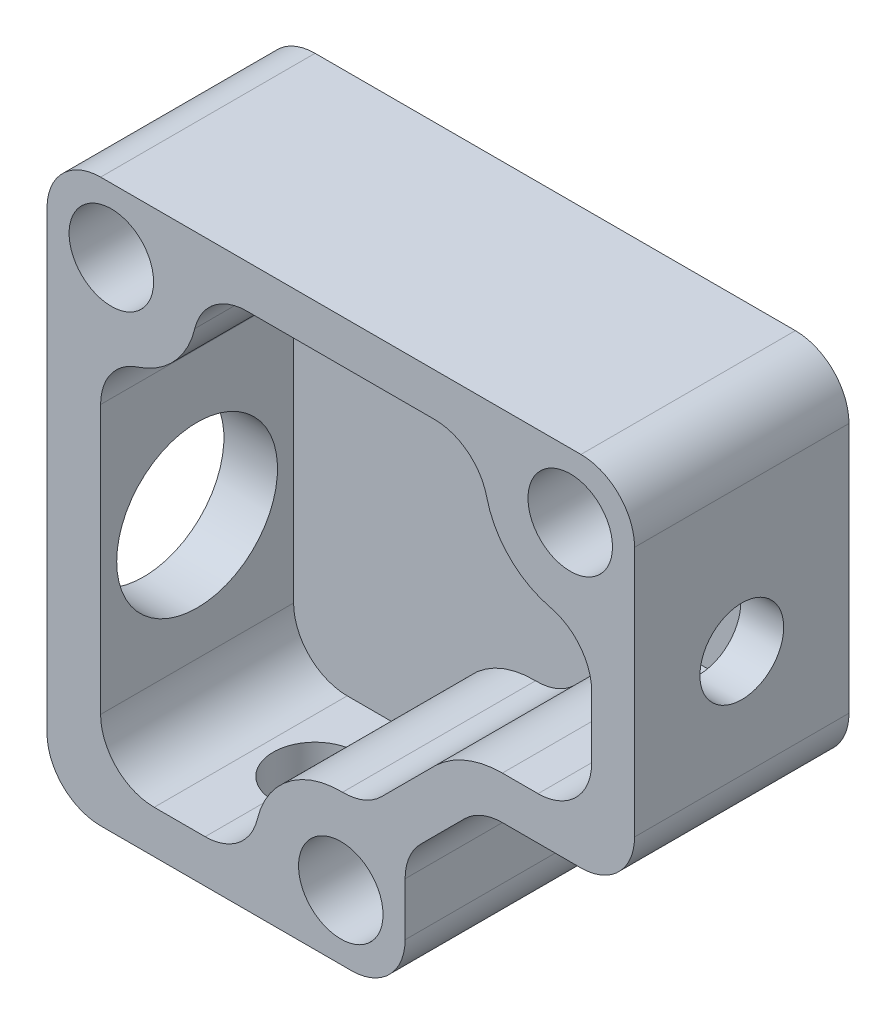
SolidWorks part; units mm, degrees
ref_plane "Front Plane" through (0, 0, 0) normal (0, 0, 1) x (1, 0, 0)
ref_plane "Top Plane" through (0, 0, 0) normal (0, 1, 0) x (1, 0, 0)
ref_plane "Right Plane" through (0, 0, 0) normal (1, 0, 0) x (0, 0, -1)
sketch "Sketch1" plane through (0, 0, 0) normal (0, 0, 1) x (1, 0, 0)
  line L1 (0, 0) -> (69.596, 0)
  line L2 (0, 0) -> (0, 66.548)
  line L3 (0, 66.548) -> (69.596, 66.548)
  line L4 (69.596, 0) -> (69.596, 66.548)
  circle A0 centre (7.62, 58.928) radius 5.0038
  circle A1 centre (61.976, 58.928) radius 5.0038
  circle A2 centre (34.798, 7.62) radius 5.0038
  dimension "D3" = 10.0076
  dimension "D4" = 10.0076
  dimension "D5" = 10.0076
  dimension "D2" = 7.62
  dimension "D6" = 7.62
  dimension "D7" = 54.356
  dimension "D8" = 7.62
  dimension "D9" = 51.308
  dimension "D10" = 61.976
  dimension "D11" = 27.178
  dimension "D12" = 7.62
extrude "Boss-Extrude1" add sketch "Sketch1" along normal blind 25.4
sketch "Sketch4" plane through (0, 0, 25.4) normal (0, 0, 1) x (1, 0, 0)
  line L1 (69.596, 0) -> (42.418, 0)
  line L2 (69.596, 0) -> (69.596, 24.13)
  line L3 (69.596, 24.13) -> (51.308, 24.13)
  line L4 (42.418, 0) -> (42.418, 15.24)
  line L5 (0, 66.548) -> (0, 0) construction
  line L6 (69.596, 66.548) -> (0, 66.548) construction
  line L7 (51.308, 24.13) -> (42.418, 15.24)
  dimension "D1" = 42.418
  dimension "D2" = 42.418
  dimension "D3" = 45
  dimension "D4" = 8.89
extrude "Cut-Extrude1" cut sketch "Sketch4" against normal blind 44.45
fillet "Fillet1" radius 6.35 2 edges at (42.418, 15.24, 12.7) (51.308, 24.13, 12.7)
fillet "Fillet2" radius 6.35 5 edges at (0, 0, 12.7) (42.418, 0, 12.7) (69.596, 24.13, 12.7) (69.596, 66.548, 12.7) (0, 66.548, 12.7)
sketch "Sketch5" plane through (0, 0, 0) normal (0, -1, 0) x (1, 0, 0)
  line L0 (6.35, 25.4) -> (36.068, 25.4) construction
  line L1 (0, 0) -> (0, 25.4) construction
  point P0 (19.05, 12.7)
  dimension "D1" = 12.7
  dimension "D2" = 19.05
hole_wizard "25/64 (0.39063) Diameter Hole1" positions "Sketch6" profile "Sketch7" hole size "25/64" standard "ANSI Inch"
sketch "Sketch6" plane through (0, 0, 0) normal (0, -1, 0) x (-1, 0, 0)
  point P0 (-19.05, -12.7)
sketch "Sketch7" plane through (19.05, 0, 12.7) normal (1, 0, 0) x (0, 0, -1)
  line L0 (0, 0) -> (0, 15.6809)
  line L1 (0, 15.6809) -> (4.961, 12.7)
  line L2 (4.961, 12.7) -> (4.961, 0)
  line L5 (4.961, 0) -> (0, 0)
  line L10 (0, 15.6809) -> (-4.961, 12.7) construction
  line L11 (0, -6.35) -> (0, 107.95) construction
  dimension "Hole Dia." = 9.922
  dimension "Hole Depth" = 12.7
  dimension "Drill Angle" = 118
sketch "Sketch11" plane through (69.596, 0, 0) normal (1, 0, 0) x (0, 0, -1)
  line L1 (-25.4, 30.48) -> (-25.4, 60.198) construction
  line L2 (0, 24.13) -> (-25.4, 24.13) construction
  point P0 (-12.7, 43.18)
  dimension "D1" = 19.05
  dimension "D2" = 12.7
hole_wizard "25/64 (0.39063) Diameter Hole2" positions "Sketch12" profile "Sketch13" hole size "25/64" standard "ANSI Inch"
sketch "Sketch12" plane through (69.596, 0, 0) normal (1, 0, 0) x (0, 0, -1)
  point P0 (-12.7, 43.18)
sketch "Sketch13" plane through (69.596, 43.18, 12.7) normal (0, 1, 0) x (0, 0, -1)
  line L0 (0, 0) -> (0, 28.3809)
  line L1 (0, 28.3809) -> (4.961, 25.4)
  line L2 (4.961, 25.4) -> (4.961, 0)
  line L5 (4.961, 0) -> (0, 0)
  line L10 (0, 28.3809) -> (-4.961, 25.4) construction
  line L11 (0, -6.35) -> (0, 107.95) construction
  dimension "Hole Dia." = 9.922
  dimension "Hole Depth" = 25.4
  dimension "Drill Angle" = 118
sketch "Sketch15" plane through (0, 0, 0) normal (-1, 0, 0) x (0, 0, 1)
  line L0 (25.4, 0) -> (0, 0) construction
  line L1 (0, 60.198) -> (0, 6.35) construction
  point P0 (13.97, 26.162)
  point P1 (21.59, 50.3921)
  dimension "D1" = 25.4
  dimension "D2" = 13.97
  dimension "D3" = 21.59
  dimension "D4" = 26.162
hole_wizard "M6x1.0 Tapped Hole2" positions "Sketch18" profile "Sketch19" tap size "M6x1.0" standard "ANSI Metric"
sketch "Sketch18" plane through (0, 0, 0) normal (-1, 0, 0) x (0, 0, 1)
  point P0 (21.59, 50.3921)
sketch "Sketch19" plane through (0, 50.3921, 21.59) normal (0, 1, 0) x (0, 0, 1)
  line L0 (0, 0) -> (0, 4.0422)
  line L1 (0, 4.0422) -> (2.5, 2.54)
  line L2 (2.5, 2.54) -> (2.5, 0)
  line L5 (2.5, 0) -> (0, 0)
  line L10 (0, 4.0422) -> (-2.5, 2.54) construction
  line L11 (0, -6.35) -> (0, 107.95) construction
  dimension "Tap Drill Dia." = 5
  dimension "Tap Drill Depth" = 2.54
  dimension "Drill Angle" = 118
hole_wizard "3/4 (0.75) Diameter Hole1" positions "Sketch20" profile "Sketch21" hole size "3/4" standard "ANSI Inch"
sketch "Sketch20" plane through (0, 0, 0) normal (-1, 0, 0) x (0, 0, 1)
  point P0 (13.97, 26.162)
sketch "Sketch21" plane through (0, 26.162, 13.97) normal (0, 1, 0) x (0, 0, 1)
  line L0 (0, 0) -> (0, 18.4232)
  line L1 (0, 18.4232) -> (9.525, 12.7)
  line L2 (9.525, 12.7) -> (9.525, 0)
  line L5 (9.525, 0) -> (0, 0)
  line L10 (0, 18.4232) -> (-9.525, 12.7) construction
  line L11 (0, -6.35) -> (0, 107.95) construction
  dimension "Hole Dia." = 19.05
  dimension "Hole Depth" = 12.7
  dimension "Drill Angle" = 118
sketch "Sketch23" plane through (0, 0, 25.4) normal (0, 0, 1) x (1, 0, 0)
  line L0 (23.6844, 61.468) -> (45.9116, 61.468)
  line L1 (64.516, 42.8636) -> (64.516, 35.56)
  line L2 (58.166, 29.21) -> (53.9393, 29.21)
  line L4 (46.0596, 26.0658) -> (37.4276, 17.4338)
  line L5 (63.246, 66.548) -> (6.35, 66.548) construction
  line L6 (69.596, 30.48) -> (69.596, 60.198) construction
  line L7 (63.246, 24.13) -> (53.9383, 24.13) construction
  line L8 (49.4481, 22.2701) -> (44.2779, 17.0999) construction
  line L9 (6.35, 43.219) -> (6.35, 11.43)
  line L10 (12.7, 5.08) -> (18.7336, 5.08)
  line L11 (0, 60.198) -> (0, 6.35) construction
  line L12 (6.35, 0) -> (36.068, 0) construction
  arc A0 (10.7462, 49.2609) -> (17.5058, 56.5834) centre (7.62, 58.928) ccw
  arc A1 (52.0902, 56.5834) -> (59.6314, 49.0422) centre (61.976, 58.928) ccw
  arc A2 (37.4276, 17.4338) -> (24.9122, 9.9646) centre (34.798, 7.62) ccw
  arc A3 (64.516, 35.56) -> (58.166, 29.21) centre (58.166, 35.56) cw
  arc A4 (53.9393, 29.21) -> (46.0596, 26.0658) centre (53.9393, 17.7643) ccw
  arc A5 (6.35, 11.43) -> (12.7, 5.08) centre (12.7, 11.43) ccw
  arc A6 (10.7462, 49.2609) -> (6.35, 43.219) centre (12.7, 43.219) ccw
  arc A7 (23.6844, 61.468) -> (17.5058, 56.5834) centre (23.6844, 55.118) ccw
  arc A8 (52.0902, 56.5834) -> (45.9116, 61.468) centre (45.9116, 55.118) ccw
  arc A9 (64.516, 42.8636) -> (59.6314, 49.0422) centre (58.166, 42.8636) ccw
  arc A10 (35.0085, 17.7778) -> (39.6301, 19.6363) centre (35.14, 24.1265) ccw
  arc A11 (18.7336, 5.08) -> (24.9122, 9.9646) centre (18.7336, 11.43) ccw
  dimension "D1" = 20.32
  dimension "D2" = 20.32
  dimension "D3" = 20.32
  dimension "D8" = 6.35
  dimension "D11" = 6.35
  dimension "D12" = 11.4457
  dimension "D13" = 12.7
  dimension "D14" = 12.7
  dimension "D15" = 12.7
  dimension "D16" = 12.7
  dimension "D17" = 12.7
  dimension "D18" = 12.7
  dimension "D4" = 5.08
  dimension "D5" = 5.08
  dimension "D6" = 5.08
  dimension "D7" = 5.08
  dimension "D9" = 6.35
  dimension "D10" = 5.08
extrude "Cut-Extrude2" cut sketch "Sketch23" against normal blind 22.86 contours L10 A11 A2 A10 L4 A4 L2 A3 L1 A9 A1 A8 L0 A7 A0 A6 L9 A5
